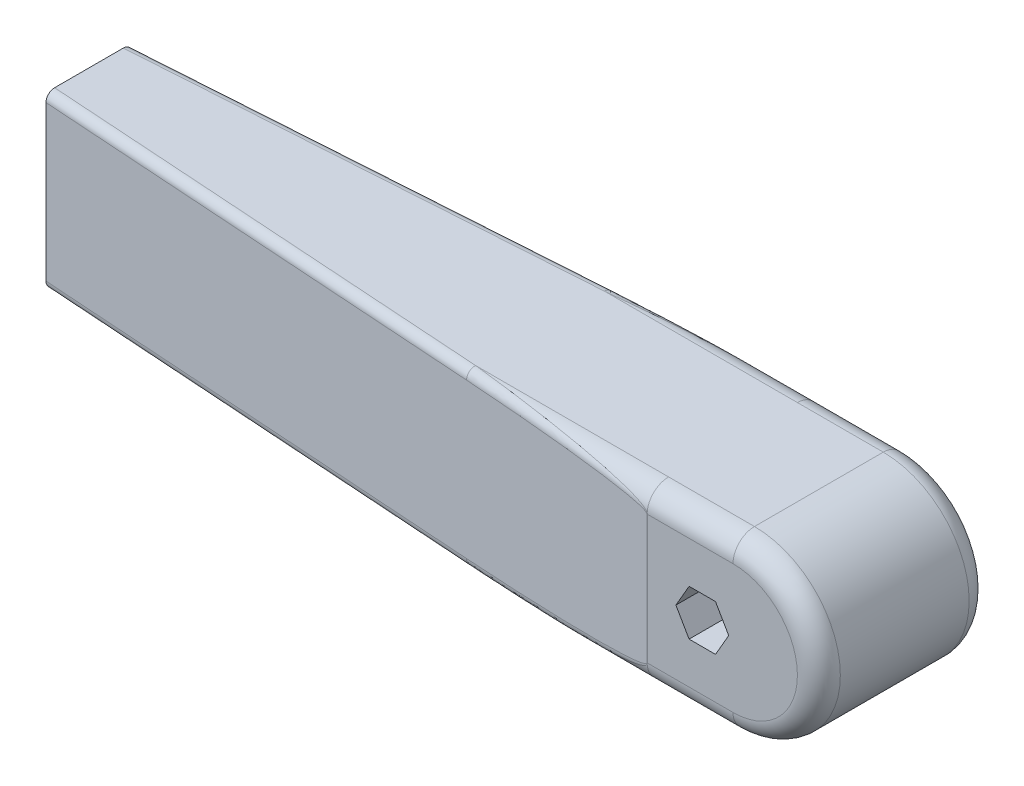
SolidWorks part; units mm, degrees
ref_plane "Alzado" through (0, 0, 0) normal (0, 0, 1) x (1, 0, 0)
ref_plane "Planta" through (0, 0, 0) normal (0, 1, 0) x (1, 0, 0)
ref_plane "Vista lateral" through (0, 0, 0) normal (1, 0, 0) x (0, 0, -1)
sketch "Croquis1" plane through (0, 0, 0) normal (0, 1, 0) x (1, 0, 0)
  line L1 (0, 0) -> (150, 0)
  line L2 (0, 0) -> (0, -40)
  line L3 (0, -40) -> (150, -40)
  line L4 (150, 0) -> (150, -40)
  dimension "D1" = 150
  dimension "D2" = 40
extrude "Saliente-Extruir1" add sketch "Croquis1" along normal blind 40
fillet "Redondeo2" radius 5 1 edges at (75, 0, 0)
fillet "Redondeo3" radius 5 3 edges at (75, 40, 0) (75, 40, 40) (75, 0, 40)
sketch "Croquis9" plane through (0, 0, 40) normal (0, 0, 1) x (1, 0, 0)
  line L0 (150, 35) -> (150, 40) construction
  line L1 (150, 40) -> (170, 40)
  line L2 (150, 40) -> (150, 0)
  line L3 (150, 0) -> (170, 0)
  arc A0 (170, 40) -> (170, 0) centre (170, 20) cw
  dimension "D1" = 20
extrude "Saliente-Extruir2" add sketch "Croquis9" against normal blind 40
fillet "Redondeo4" radius 5 6 edges at (160, 40, 0) (160, 0, 0) (190, 20, 0) (160, 40, 40) (190, 20, 40) (160, 0, 40)
sketch "Croquis6" plane through (0, 0, 0) normal (0, 0, -1) x (-1, 0, 0)
  line L1 (-159.775, 14.6739) -> (-156.7, 20)
  line L2 (-156.7, 20) -> (-159.775, 25.3261)
  line L3 (-159.775, 25.3261) -> (-165.925, 25.3261)
  line L4 (-165.925, 25.3261) -> (-169, 20)
  line L5 (-169, 20) -> (-165.925, 14.6739)
  line L6 (-165.925, 14.6739) -> (-159.775, 14.6739)
  circle A0 centre (-162.85, 20) radius 5.3261 construction
  arc A1 (-170, 35) -> (-170, 5) centre (-170, 20) ccw construction
  dimension "D1" = 12.3
  dimension "D2" = 1
extrude "Cortar-Extruir2" cut sketch "Croquis6" against normal blind 86
sketch "Croquis10" plane through (0, 0, 0) normal (-1, 0, 0) x (0, 0, 1)
  line L0 (5, 40) -> (35, 40) construction
  line L1 (0, 35) -> (0, 5) construction
  circle A0 centre (20, 38) radius 0.75
  circle A1 centre (20, 20) radius 0.75
  dimension "D3" = 1.5
  dimension "D4" = 1.5
  dimension "D1" = 18
  dimension "D2" = 2
  dimension "D5" = 20
extrude "Cortar-Extruir3" cut sketch "Croquis10" against normal blind 16
sketch "Croquis12" plane through (0, 0, 0) normal (0, 0, -1) x (-1, 0, 0)
  line L0 (-169, 20) -> (-156.7, 20)
  line L1 (-156.7, 20) -> (-159.775, 25.3261) construction
  circle A0 centre (-162.85, 20) radius 12.15
  dimension "D1" = 24.3
extrude "Cortar-Extruir5" cut sketch "Croquis12" against normal blind 8 contours A0 M6 M1 M2 M3 M4 M5
sketch "Croquis14" plane through (0, 40, 0) normal (0, 1, 0) x (1, 0, 0)
  line L0 (150, 0) -> (0, -10)
  line L1 (0, -5) -> (0, -35) construction
  line L2 (150, -40) -> (0, -30)
  line L3 (0, -30) -> (0, -40)
  line L4 (0, -35) -> (0, -40) construction
  line L5 (150, -40) -> (0, -40) construction
  line L6 (0, -40) -> (150, -40)
  line L7 (0, -10) -> (0, 0)
  line L8 (0, 0) -> (150, 0)
extrude "Cortar-Extruir6" cut sketch "Croquis14" against normal blind 100
fillet "Redondeo5" radius 2 10 edges at (128.033, 1.4645, 38.5355) (150, 20, 40) (128.033, 38.5355, 38.5355) (128.033, 1.4645, 1.4645) (150, 20, 0) (128.033, 38.5355, 1.4645) (37.5, 0, 32.5) (37.5, 0, 7.5) (37.5, 40, 32.5) (37.5, 40, 7.5)
